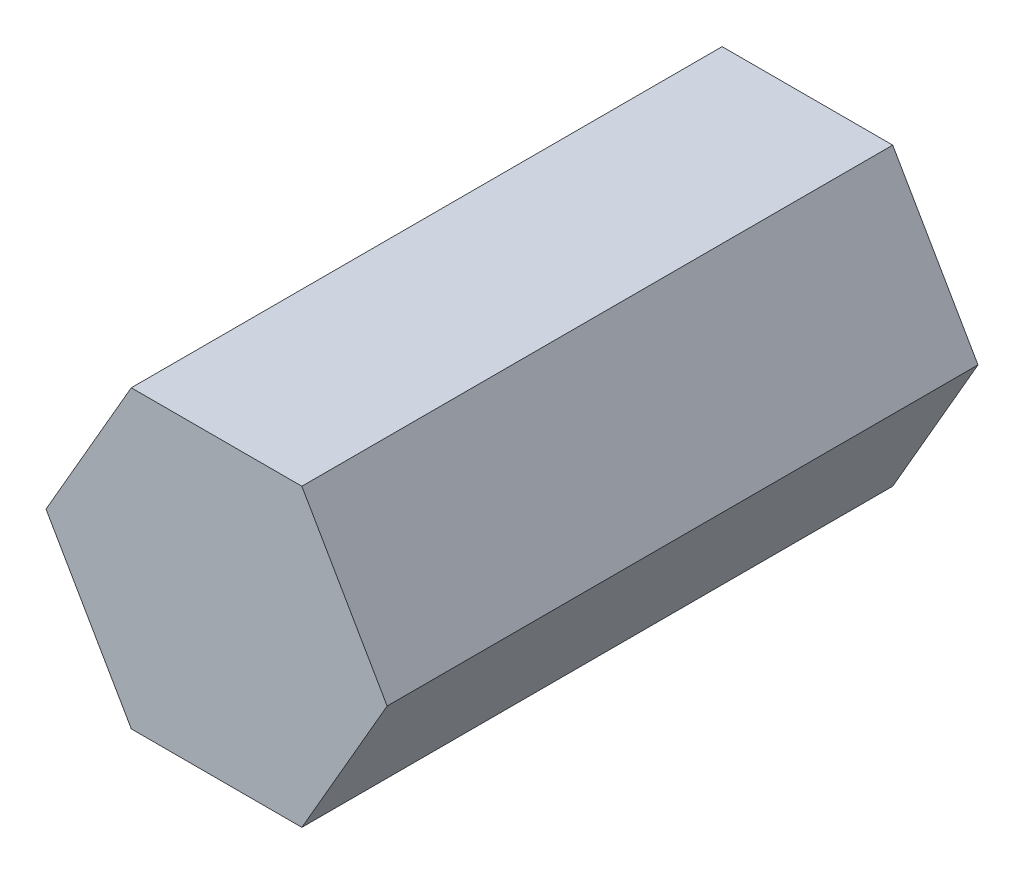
SolidWorks part; units mm, degrees
ref_plane "Face" through (0, 0, 0) normal (0, 0, 1) x (1, 0, 0)
ref_plane "Dessus" through (0, 0, 0) normal (0, 1, 0) x (1, 0, 0)
ref_plane "Droite" through (0, 0, 0) normal (1, 0, 0) x (0, 0, -1)
sketch "Esquisse1" plane through (0, 0, 0) normal (0, 0, 1) x (1, 0, 0)
  line L1 (1.7321, 0) -> (0.866, 1.5)
  line L2 (0.866, 1.5) -> (-0.866, 1.5)
  line L3 (-0.866, 1.5) -> (-1.7321, 0)
  line L4 (-1.7321, 0) -> (-0.866, -1.5)
  line L5 (-0.866, -1.5) -> (0.866, -1.5)
  line L6 (0.866, -1.5) -> (1.7321, 0)
  circle A0 centre (0, 0) radius 1.5 construction
  dimension "D1" = 3
extrude "Extrusion1" add sketch "Esquisse1" along normal blind 6
